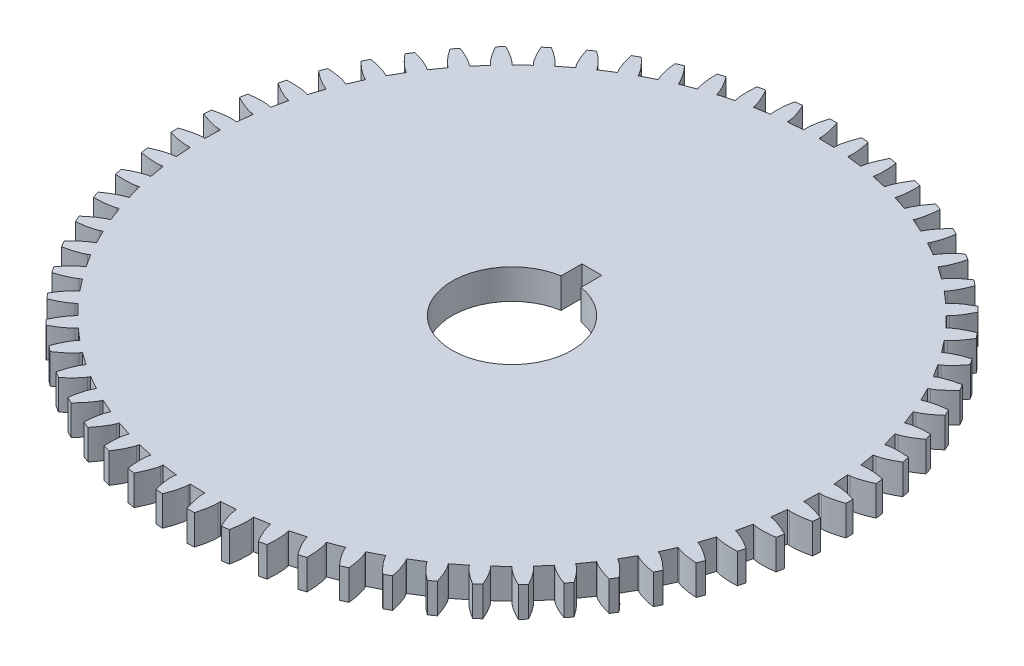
SolidWorks part; units mm, degrees
ref_plane "Front Plane" through (0, 0, 0) normal (0, 0, 1) x (1, 0, 0)
ref_plane "Top Plane" through (0, 0, 0) normal (0, 1, 0) x (1, 0, 0)
ref_plane "Right Plane" through (0, 0, 0) normal (1, 0, 0) x (0, 0, -1)
sketch "Sketch1" plane through (0, 0, 0) normal (0, 1, 0) x (1, 0, 0)
  line L0 (0, 0) -> (0, 15.4904) construction
  line L1 (0, 0) -> (-15.4904, 0) construction
  line L2 (0, 0) -> (-16.495, -0.4049) construction
  line L3 (0, 0) -> (-15.4717, -0.7601) construction
  line L4 (0, 0) -> (-15.4158, -1.5183) construction
  circle A0 centre (0, 0) radius 16 construction
  circle A1 centre (0, 0) radius 15.4904 construction
  circle A2 centre (0, 0) radius 15.375 construction
  circle A3 centre (0, 0) radius 16.5 construction
  spline S0 degree 4 poles (-15.4904, 0) (-15.5169, 0) (-15.5911, -0.0027) (-15.731, -0.0186) (-15.9571, -0.0597) (-16.2409, -0.1342) (-16.6008, -0.2552) (-17.0142, -0.4291) (-17.4552, -0.6523) (-17.9184, -0.9284) (-18.3641, -1.2326) (-18.7919, -1.5613) (-19.2022, -1.9118) (-19.6787, -2.3607) (-20.2209, -2.9349) (-20.8083, -3.6496) (-21.4174, -4.5168) (-21.9725, -5.443) (-22.4637, -6.4037) (-22.8391, -7.271) (-23.1228, -8.0279) (-23.3345, -8.6697) (-23.489, -9.1835) (-23.6643, -9.8404) (-23.8152, -10.487) (-23.9435, -11.1652) (-24.0686, -11.9401) (-24.1523, -12.6533) (-24.2099, -13.2503) (-24.2505, -14.0054) (-24.264, -14.391) (-24.2729, -14.9355) (-24.2689, -15.3393) (-24.2617, -15.7064) (-24.2528, -15.9118) (-24.2482, -16.0316) knots 0 0 0 0 0 0.005377 0.015084 0.028532 0.04661 0.064855 0.092111 0.119476 0.146842 0.174209 0.201575 0.228941 0.256307 0.307035 0.361767 0.4165 0.471232 0.525964 0.580697 0.608063 0.635429 0.662795 0.690161 0.744894 0.77226 0.799626 0.854358 0.881725 0.909091 0.931818 0.954545 0.977273 1 1 1 1 1 construction
  spline S1 degree 4 poles (-15.4904, 0) (-15.5169, 0) (-15.5911, -0.0027) (-15.731, -0.0186) (-15.9571, -0.0597) (-16.2409, -0.1342) (-16.6008, -0.2552) (-17.0142, -0.4291) (-17.4552, -0.6523) (-17.9184, -0.9284) (-18.3641, -1.2326) (-18.7919, -1.5613) (-19.2022, -1.9118) (-19.6787, -2.3607) (-20.2209, -2.9349) (-20.8083, -3.6496) (-21.4174, -4.5168) (-21.9725, -5.443) (-22.4637, -6.4037) (-22.8391, -7.271) (-23.1228, -8.0279) (-23.3345, -8.6697) (-23.489, -9.1835) (-23.6643, -9.8404) (-23.8152, -10.487) (-23.9435, -11.1652) (-24.0686, -11.9401) (-24.1523, -12.6533) (-24.2099, -13.2503) (-24.2435, -13.8756) (-24.2537, -14.1161) (-24.2578, -14.2386) knots 0 0 0 0 0 0.005377 0.015084 0.028532 0.04661 0.064855 0.092111 0.119476 0.146842 0.174209 0.201575 0.228941 0.256307 0.307035 0.361767 0.4165 0.471232 0.525964 0.580697 0.608063 0.635429 0.662795 0.690161 0.744894 0.77226 0.799626 0.854358 0.881725 0.909091 0.909091 0.909091 0.909091 0.909091
  dimension "D1" = 33
  dimension "D2" = 32
  dimension "D3" = 30.9807
  dimension "D4" = 30.75
  dimension "D5" = 15.4904
  dimension "D6" = 1.406
  dimension "D7" = 2.813
  dimension "D8" = 5.625
sketch "Sketch2" plane through (0, 0, 0) normal (0, 1, 0) x (1, 0, 0)
  line L0 (0, 0) -> (-16.495, -0.4049) construction
  line L1 (0, 0) -> (-16.495, -0.4049) construction
  line L2 (0, 0) -> (-15.4717, -0.7601) construction
  line L3 (0, 0) -> (-15.4904, 0) construction
  line L4 (0, 0) -> (-15.4158, -1.5183) construction
  line L5 (0, 0) -> (-15.4717, -0.7601) construction
  line L6 (0, 0) -> (-15.4904, 0) construction
  line L7 (0, 0) -> (-15.4158, -1.5183) construction
  line L8 (-15.4717, -0.7601) -> (-15.3565, -0.7544)
  line L9 (-15.3565, -0.7544) -> (-15.301, -1.507)
  line L10 (-15.301, -1.507) -> (-15.4158, -1.5183) construction
  line L11 (-15.301, -1.507) -> (-2.9856, -0.2941)
  line L12 (-15.4904, 0) -> (-3, 0)
  circle A0 centre (0, 0) radius 15.375 construction
  circle A1 centre (0, 0) radius 15.4904 construction
  circle A2 centre (0, 0) radius 16 construction
  circle A3 centre (0, 0) radius 16.5 construction
  circle A4 centre (0, 0) radius 15.375 construction
  circle A5 centre (0, 0) radius 15.4904 construction
  circle A6 centre (0, 0) radius 16 construction
  circle A7 centre (0, 0) radius 16.5 construction
  arc A8 (-16.4896, -0.5857) -> (-16.4985, -0.2241) centre (0, 0) cw
  circle A11 centre (0, 0) radius 3 construction
  arc A12 (-3, 0) -> (-2.9856, -0.2941) centre (0, 0) ccw
  spline S0 degree 4 poles (-74.7598, -1998.8887) (-11.1782, -43.2906) (-12.0624, -0.9289) (-14.0898, 0.2799) (-15.9571, -0.0597) (-16.2409, -0.1342) (-16.6008, -0.2552) (-17.0142, -0.4291) (-17.4552, -0.6523) (-17.9184, -0.9284) (-18.3641, -1.2326) (-18.7919, -1.5613) (-19.2022, -1.9118) (-19.6787, -2.3607) (-20.2209, -2.9349) (-20.8083, -3.6496) (-21.4174, -4.5168) (-21.9725, -5.443) (-22.4637, -6.4037) (-22.8391, -7.271) (-23.1228, -8.0279) (-23.3345, -8.6697) (-23.489, -9.1835) (-23.6643, -9.8404) (-23.8152, -10.487) (-23.9435, -11.1652) (-24.0686, -11.9401) (-24.1523, -12.6533) (-24.3829, -15.0417) (-24.3201, -20.6423) (-21.8513, 38.624) (-89.4077, -2013.0629) knots -0.338384 -0.338384 -0.338384 -0.338384 -0.338384 0.005377 0.015084 0.028532 0.04661 0.064855 0.092111 0.119476 0.146842 0.174209 0.201575 0.228941 0.256307 0.307035 0.361767 0.4165 0.471232 0.525964 0.580697 0.608063 0.635429 0.662795 0.690161 0.744894 0.77226 0.799626 0.854358 0.881725 1.319658 1.319658 1.319658 1.319658 1.319658 only from (-15.4904, 0) to (-24.2578, -14.2386) construction
  spline S1 degree 4 poles (-15.4904, 0) (-15.5169, 0) (-15.5911, -0.0027) (-15.731, -0.0186) (-15.9571, -0.0597) (-16.1824, -0.1188) (-16.3587, -0.1749) (-16.4707, -0.2141) (-16.4985, -0.2241) knots 0 0 0 0 0 0.005377 0.015084 0.028532 0.04661 0.05261 0.05261 0.05261 0.05261 0.05261
  spline S2 degree 4 poles (-15.4717, -0.7601) (-15.4982, -0.7614) (-15.5725, -0.7623) (-15.713, -0.7533) (-15.9408, -0.7233) (-16.1688, -0.6753) (-16.3476, -0.628) (-16.4613, -0.5943) (-16.4896, -0.5857) knots 0 0 0 0 0 0.005377 0.015084 0.028532 0.04661 0.05261 0.05261 0.05261 0.05261 0.05261
  point P21 (-15.3565, -0.7544)
  point P24 (-15.301, -1.507)
  dimension "D2" = 6
extrude "Boss-Extrude1" add sketch "Sketch2" along normal blind 1.5
pattern_circular "CirPattern1" count 64 over 360 of "Boss-Extrude1"
sketch "Sketch3" plane through (0, 1.5, 0) normal (0, 1, 0) x (1, 0, 0)
  line L1 (0.5, 2) -> (-0.5, 2)
  line L2 (0.5, 2) -> (0.5, 4)
  line L3 (0.5, 4) -> (-0.5, 4)
  line L4 (-0.5, 2) -> (-0.5, 4)
  line L5 (0.5, 2) -> (-0.5, 4) construction
  line L6 (0.5, 4) -> (-0.5, 2) construction
  circle A0 centre (0, 0) radius 3 construction
  point P0 (0, 3)
  dimension "D1" = 2
  dimension "D2" = 1
extrude "Cut-Extrude1" cut sketch "Sketch3" against normal up to surface (1.5 mm away)
equation "\"Module\"= .5"
equation "\"Number of Teeth\"= 64"
equation "\"Pressure Angle\"= 14.5deg"
equation "\"Pitch Diameter\"= \"Number of Teeth\" * \"Module\""
equation "\"Circular Pitch\"= pi * \"Module\""
equation "\"Addendum\"= \"Module\""
equation "\"Dedendum\"= 1.25 * \"Module\""
equation "\"Base Diameter\"= \"Pitch Diameter\" * cos ( \"Pressure Angle\" )"
equation "\"Base Radius\"= \"Base Diameter\" / 2"
equation "\"Width\"= 1.5"
equation "\"Outside Diameter\"= \"Pitch Diameter\" + 2 * \"Addendum\""
equation "\"D1@Sketch1\"=\"Outside Diameter\""
equation "\"D3@Sketch1\"=\"Base Diameter\""
equation "\"Root Diameter\"= \"Pitch Diameter\" - 2 * \"Dedendum\""
equation "\"D4@Sketch1\"=\"Root Diameter\""
equation "\"Tooth Angle\"= 360 / \"Number of Teeth\""
equation "\"D6@Sketch1\"=\"Tooth Angle\"/4"
equation "\"D7@Sketch1\"=\"Tooth Angle\"/2"
equation "\"D8@Sketch1\"=\"Tooth Angle\""
equation "\"D2@Sketch1\" = \"Pitch Diameter\""
equation "\"Shaft Diameter\" = 6"
equation "\"D1@CirPattern1\" = \"Number of Teeth\""
equation "\"D2@Sketch2\"= \"Shaft Diameter\""
equation "\"D1@Boss-Extrude1\" = \"Width\""
